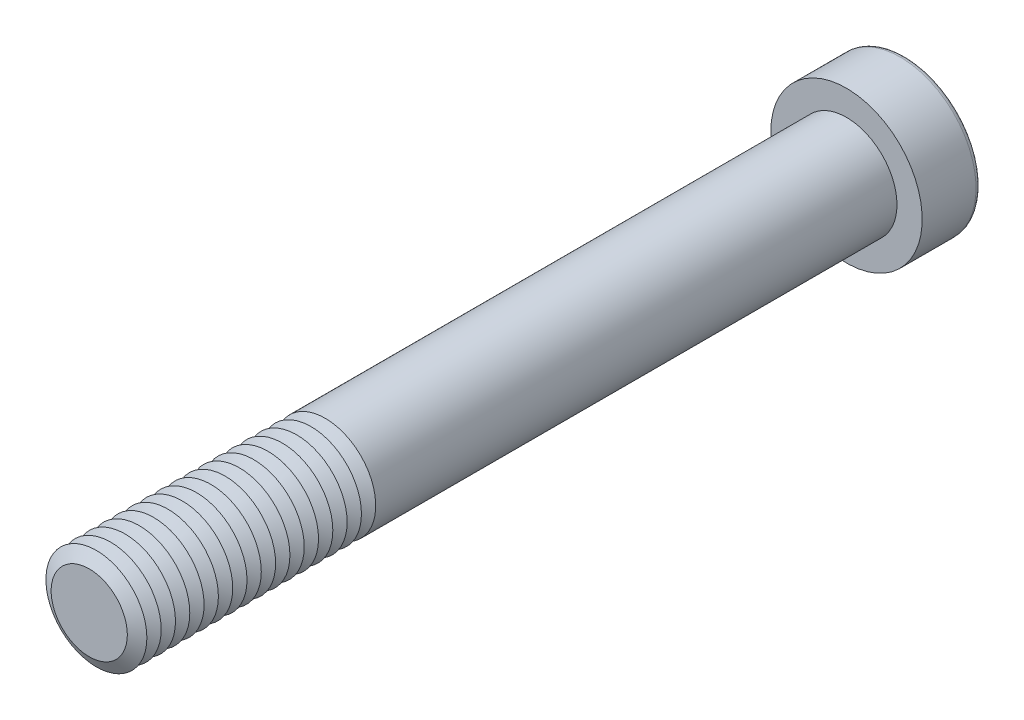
SolidWorks part; units mm, degrees
ref_plane "Front Plane" through (0, 0, 0) normal (0, 0, 1) x (1, 0, 0)
ref_plane "Top Plane" through (0, 0, 0) normal (0, 1, 0) x (1, 0, 0)
ref_plane "Right Plane" through (0, 0, 0) normal (1, 0, 0) x (0, 0, -1)
sketch "Sketch1" plane through (0, 0, 0) normal (0, 0, 1) x (1, 0, 0)
  circle A0 centre (0, 0) radius 6
  dimension "D1" = 12
extrude "Boss-Extrude1" add sketch "Sketch1" along normal blind 90
sketch "Sketch2" plane through (0, 0, 0) normal (0, 0, -1) x (-1, 0, 0)
  circle A0 centre (0, 0) radius 9
  dimension "D1" = 18
extrude "Boss-Extrude2" add sketch "Sketch2" along normal blind 7
sketch "Sketch3" plane through (0, 0, -7) normal (0, 0, -1) x (-1, 0, 0)
  line L1 (-2.3094, 4) -> (-4.6188, 0)
  line L2 (-4.6188, 0) -> (-2.3094, -4)
  line L3 (-2.3094, -4) -> (2.3094, -4)
  line L4 (2.3094, -4) -> (4.6188, 0)
  line L5 (4.6188, 0) -> (2.3094, 4)
  line L6 (2.3094, 4) -> (-2.3094, 4)
  circle A0 centre (0, 0) radius 4 construction
  dimension "D1" = 8
extrude "Cut-Extrude1" cut sketch "Sketch3" against normal blind 6
fillet "Fillet1" radius 0.6 1 edges at (-9, 0, -7)
sketch "Sketch4" plane through (0, 0, -1) normal (0, 0, -1) x (-1, 0, 0)
  line L0 (2.3094, -4) -> (4.6188, 0) construction
  circle A0 centre (0, 0) radius 4
extrude "Cut-Extrude2" cut sketch "Sketch4" against normal through all draft 60
sketch "Sketch5" plane through (0, 0, -7) normal (0, 0, -1) x (-1, 0, 0)
  circle A0 centre (0, 0) radius 4.6188
extrude "Cut-Extrude3" cut sketch "Sketch5" against normal through all draft 75
sketch "Sketch7" plane through (0, 0, 0) normal (1, 0, 0) x (0, 0, -1)
  line L25 (-90, 4.5278) -> (-89.15, 6)
  line L26 (-90, 6) -> (-90, -6) construction
  line L27 (-89.15, 6) -> (-90.85, 6)
  line L28 (-90.85, 6) -> (-90, 4.5278)
  line L29 (0, 6) -> (-90, 6) construction
  dimension "D1" = 1.7
revolve "Cut-Revolve1" cut sketch "Sketch7" angle 360 about axis through (0, 0, 90) along (0, 0, -1)
pattern_linear "LPattern1" count 17 spacing 1.7 along (0, 0, -1) of "Cut-Revolve1"
